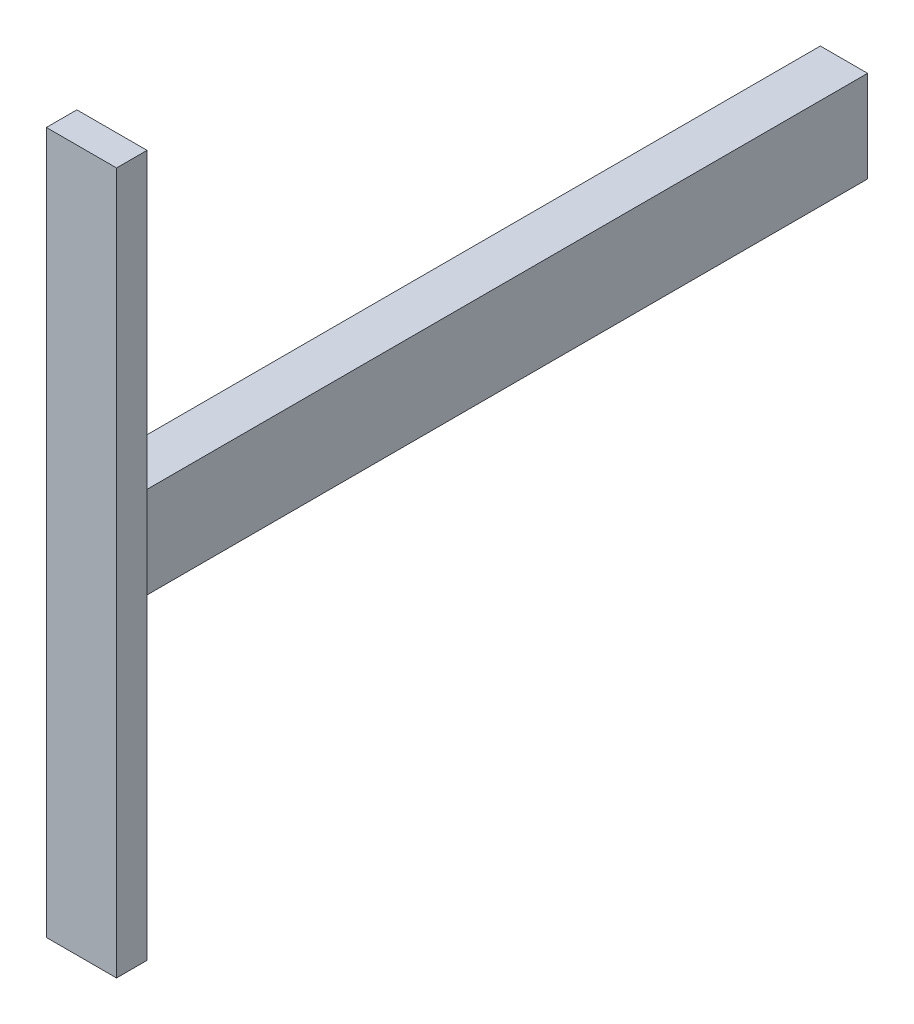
SolidWorks part; units mm, degrees
ref_plane "Front Plane" through (0, 0, 0) normal (0, 0, 1) x (1, 0, 0)
ref_plane "Top Plane" through (0, 0, 0) normal (0, 1, 0) x (1, 0, 0)
ref_plane "Right Plane" through (0, 0, 0) normal (1, 0, 0) x (0, 0, -1)
sketch "Sketch1" plane through (0, 0, 0) normal (0, 1, 0) x (1, 0, 0)
  line L1 (-29.21, 12.7) -> (29.21, 12.7)
  line L2 (-29.21, 12.7) -> (-29.21, -12.7)
  line L3 (-29.21, -12.7) -> (29.21, -12.7)
  line L4 (29.21, 12.7) -> (29.21, -12.7)
  line L5 (-29.21, 12.7) -> (29.21, -12.7) construction
  line L6 (-29.21, -12.7) -> (29.21, 12.7) construction
  point P0 (0, 0)
  dimension "D1" = 58.42
  dimension "D2" = 25.4
extrude "Boss-Extrude1" add sketch "Sketch1" along normal blind 584.2
sketch "Sketch2" plane through (0, 0, -12.7) normal (0, 0, -1) x (-1, 0, 0)
  line L1 (-19.685, 254) -> (19.685, 254)
  line L2 (-19.685, 254) -> (-19.685, 330.2)
  line L3 (-19.685, 330.2) -> (19.685, 330.2)
  line L4 (19.685, 254) -> (19.685, 330.2)
  line L5 (29.21, 584.2) -> (29.21, 0) construction
  line L6 (-29.21, 584.2) -> (29.21, 584.2) construction
  line L7 (-16.51, 257.175) -> (16.51, 257.175)
  line L8 (-16.51, 257.175) -> (-16.51, 327.025)
  line L9 (-16.51, 327.025) -> (16.51, 327.025)
  line L10 (16.51, 257.175) -> (16.51, 327.025)
  line L11 (-29.21, 584.2) -> (-29.21, 0) construction
  point P12 (0, 257.175)
  point P15 (0, 584.2)
  point P16 (16.51, 292.1)
  point P17 (19.685, 292.1)
  point P18 (29.21, 292.1)
  point P19 (0, 0)
  point P20 (0, 0)
  dimension "D1" = 3.175
  dimension "D2" = 3.175
  dimension "D3" = 76.2
  dimension "D4" = 9.525
  dimension "D5" = 3.175
extrude "Boss-Extrude2" add sketch "Sketch2" along normal blind 609.6
